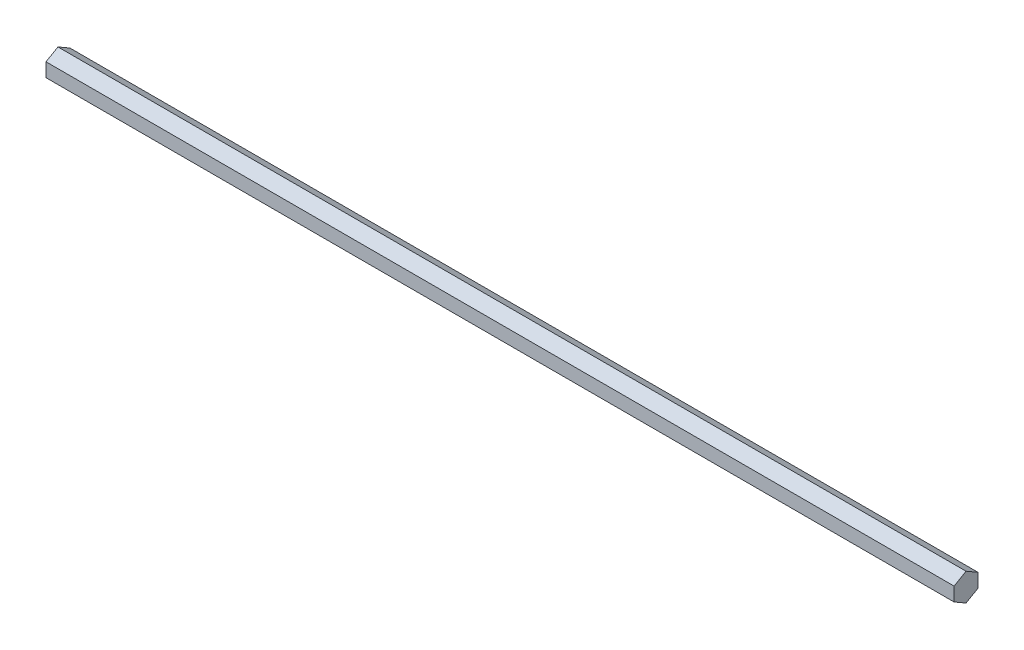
SolidWorks part; units mm, degrees
ref_plane "Plan de face" through (0, 0, 0) normal (0, 0, 1) x (1, 0, 0)
ref_plane "Plan de dessus" through (0, 0, 0) normal (0, 1, 0) x (1, 0, 0)
ref_plane "Plan de droite" through (0, 0, 0) normal (1, 0, 0) x (0, 0, -1)
sketch "Esquisse1" plane through (0, 0, 0) normal (1, 0, 0) x (0, 0, -1)
  line L1 (0, 1.5184) -> (-1.315, 0.7592)
  line L2 (-1.315, 0.7592) -> (-1.315, -0.7592)
  line L3 (-1.315, -0.7592) -> (0, -1.5184)
  line L4 (0, -1.5184) -> (1.315, -0.7592)
  line L5 (1.315, -0.7592) -> (1.315, 0.7592)
  line L6 (1.315, 0.7592) -> (0, 1.5184)
  circle A0 centre (0, 0) radius 1.315 construction
extrude "Boss.-Extru.1" add sketch "Esquisse1" along normal blind 100
